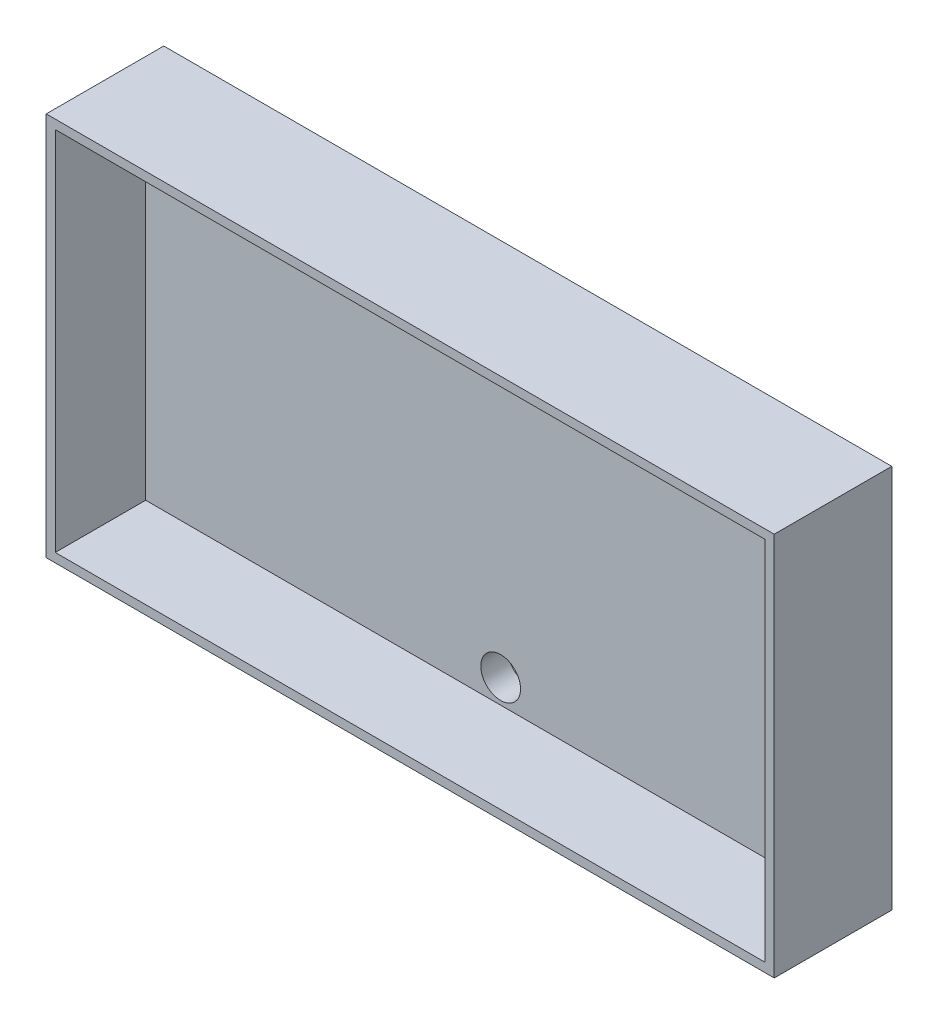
SolidWorks part; units mm, degrees
ref_plane "Front Plane" through (0, 0, 0) normal (0, 0, 1) x (1, 0, 0)
ref_plane "Top Plane" through (0, 0, 0) normal (0, 1, 0) x (1, 0, 0)
ref_plane "Right Plane" through (0, 0, 0) normal (1, 0, 0) x (0, 0, -1)
sketch "Sketch1" plane through (0, 0, 0) normal (0, 0, 1) x (1, 0, 0)
  line L0 (-1000, 0) -> (49000, 0) construction
  line L1 (-39.25, 20.25) -> (39.25, 20.25)
  line L2 (-39.25, 20.25) -> (-39.25, -20.25)
  line L3 (-39.25, -20.25) -> (39.25, -20.25)
  line L4 (39.25, 20.25) -> (39.25, -20.25)
  line L5 (0, -1000) -> (0, 49000) construction
  dimension "D1" = 78.5
  dimension "D2" = 40.5
extrude "Vysunout tenkostěnný1" add sketch "Sketch1" along normal blind 10 thin
sketch "Skica1" plane through (0, 0, 0) normal (0, 0, 1) x (1, 0, 0)
  line L0 (-40.25, -21.25) -> (40.25, -21.25) construction
  line L1 (-40.25, 21.25) -> (-40.25, -21.25) construction
  line L2 (40.25, -21.25) -> (40.25, 21.25) construction
  line L3 (40.25, 21.25) -> (-40.25, 21.25) construction
  line L4 (-40.25, -21.25) -> (40.25, -21.25)
  line L5 (-40.25, 21.25) -> (-40.25, -21.25)
  line L6 (40.25, -21.25) -> (40.25, 21.25)
  line L7 (40.25, 21.25) -> (-40.25, 21.25)
extrude "Přidat vysunutím1" add sketch "Skica1" against normal blind 3
sketch "Sketch3" plane through (0, 0, 0) normal (0, 0, 1) x (1, 0, 0)
  line L0 (-1000, 0) -> (49000, 0) construction
  circle A0 centre (0, -17.6) radius 2.2
  circle A1 centre (0, 17.6) radius 2.2
  point P4 (0, 0)
  dimension "D1" = 4.4
  dimension "D2" = 4.4
  dimension "D3" = 35.2
extrude "Cut-Extrude2" cut sketch "Sketch3" against normal through all both and the other way through all
